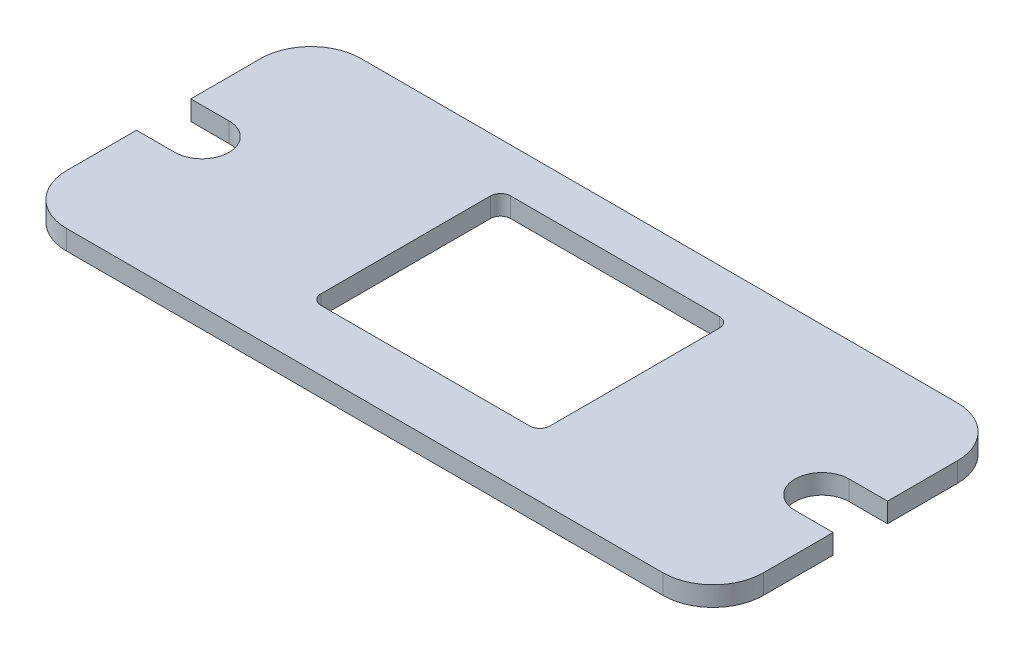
SolidWorks part; units mm, degrees
ref_plane "Front Plane" through (0, 0, 0) normal (0, 0, 1) x (1, 0, 0)
ref_plane "Top Plane" through (0, 0, 0) normal (0, 1, 0) x (1, 0, 0)
ref_plane "Right Plane" through (0, 0, 0) normal (1, 0, 0) x (0, 0, -1)
sketch "Sketch1" plane through (0, 0, 0) normal (0, 1, 0) x (1, 0, 0)
  line L1 (-27.051, 11.43) -> (27.051, 11.43)
  line L2 (-27.051, 11.43) -> (-27.051, -11.43)
  line L3 (-27.051, -11.43) -> (27.051, -11.43)
  line L4 (27.051, 11.43) -> (27.051, -11.43)
  line L5 (-27.051, 11.43) -> (27.051, -11.43) construction
  line L6 (-27.051, -11.43) -> (27.051, 11.43) construction
  point P0 (0, 0)
extrude "Boss-Extrude1" add sketch "Sketch1" along normal blind 1.524
sketch "Sketch2" plane through (0, 1.524, 0) normal (0, 1, 0) x (1, 0, 0)
  line L0 (-24.0792, 2.1082) -> (-27.051, 2.1082)
  line L1 (-27.051, 11.43) -> (-27.051, -11.43) construction
  line L2 (-24.0792, -2.1082) -> (-27.051, -2.1082)
  line L3 (24.0792, 2.1082) -> (27.051, 2.1082)
  line L4 (27.051, -11.43) -> (27.051, 11.43) construction
  line L5 (24.0792, -2.1082) -> (27.051, -2.1082)
  line L6 (-27.051, -2.1082) -> (-27.051, 2.1082)
  line L7 (27.051, -2.1082) -> (27.051, 2.1082)
  arc A0 (-24.0792, -2.1082) -> (-24.0792, 2.1082) centre (-24.0792, 0) ccw
  arc A1 (24.0792, 2.1082) -> (24.0792, -2.1082) centre (24.0792, 0) ccw
extrude "Cut-Extrude1" cut sketch "Sketch2" against normal through all
fillet "Fillet1" radius 3.8989 1 edges at (-27.051, 0.762, -11.43)
fillet "Fillet2" radius 3.8989 1 edges at (-27.051, 0.762, 11.43)
fillet "Fillet3" radius 3.8989 2 edges at (27.051, 0.762, 11.43) (27.051, 0.762, -11.43)
sketch "Sketch7" plane through (0, 1.524, 0) normal (0, 1, 0) x (1, 0, 0)
  line L8 (-8.89, -6.731) -> (8.89, -6.731)
  line L9 (-8.89, -6.731) -> (-8.89, 8.001)
  line L10 (-8.89, 8.001) -> (8.89, 8.001)
  line L11 (8.89, -6.731) -> (8.89, 8.001)
  line L12 (-8.89, -6.731) -> (8.89, 8.001) construction
  line L13 (-8.89, 8.001) -> (8.89, -6.731) construction
  point P16 (0, 0.635)
extrude "Cut-Extrude2" cut sketch "Sketch7" against normal through all
fillet "Fillet4" radius 0.7874 4 edges at (8.89, 0.762, 6.731) (-8.89, 0.762, 6.731) (8.89, 0.762, -8.001) (-8.89, 0.762, -8.001)
